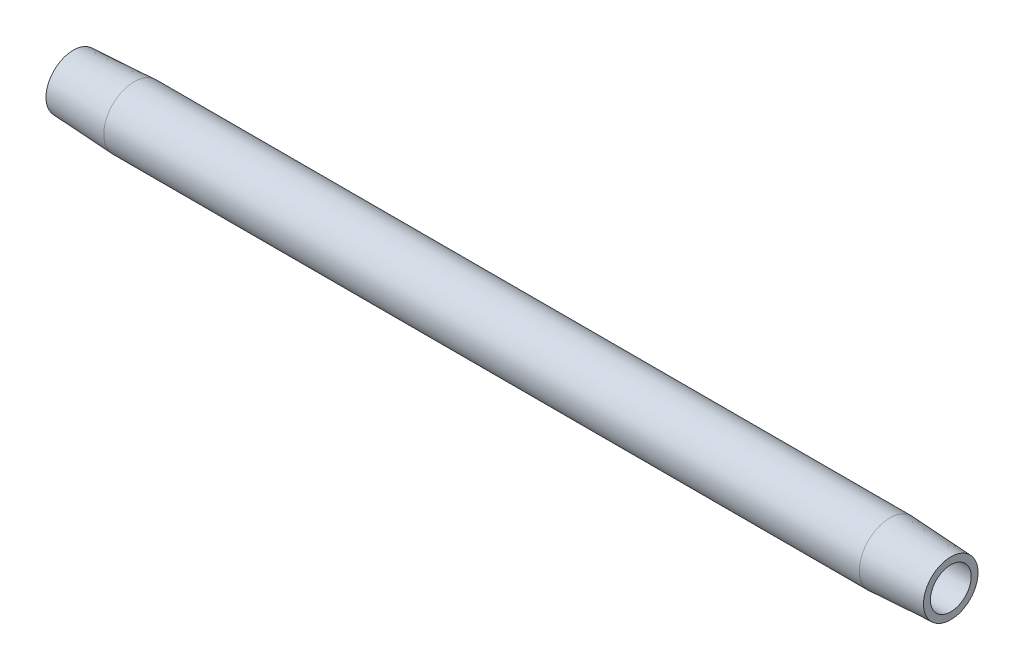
SolidWorks part; units mm, degrees
ref_plane "Front Plane" through (0, 0, 0) normal (0, 0, 1) x (1, 0, 0)
ref_plane "Top Plane" through (0, 0, 0) normal (0, 1, 0) x (1, 0, 0)
ref_plane "Right Plane" through (0, 0, 0) normal (1, 0, 0) x (0, 0, -1)
sketch "Sketch2" plane through (0, 0, 0) normal (0, 0, 1) x (1, 0, 0)
  line L0 (0.4761, 0) -> (50000.4761, 0) construction
  line L1 (0, -11.3625) -> (0, 49988.6375) construction
  line L7 (7.9375, 3.9687) -> (0, 3.5528)
  line L8 (106.3625, 3.9688) -> (7.9375, 3.9687)
  line L9 (114.3, 3.5528) -> (106.3625, 3.9688)
  line L10 (114.3, 2.6543) -> (114.3, 3.5528)
  line L11 (114.3, 2.6543) -> (0, 2.6543)
  line L12 (0, 3.5528) -> (0, 2.6543)
  dimension "D1" = 5.3086
  dimension "D2" = 7.9375
  dimension "D3" = 3
  dimension "D4" = 3
  dimension "D5" = 7.9375
  dimension "D6" = 7.9375
  dimension "D7" = 114.3
revolve "Revolve1" add sketch "Sketch2" angle 360 about L0
